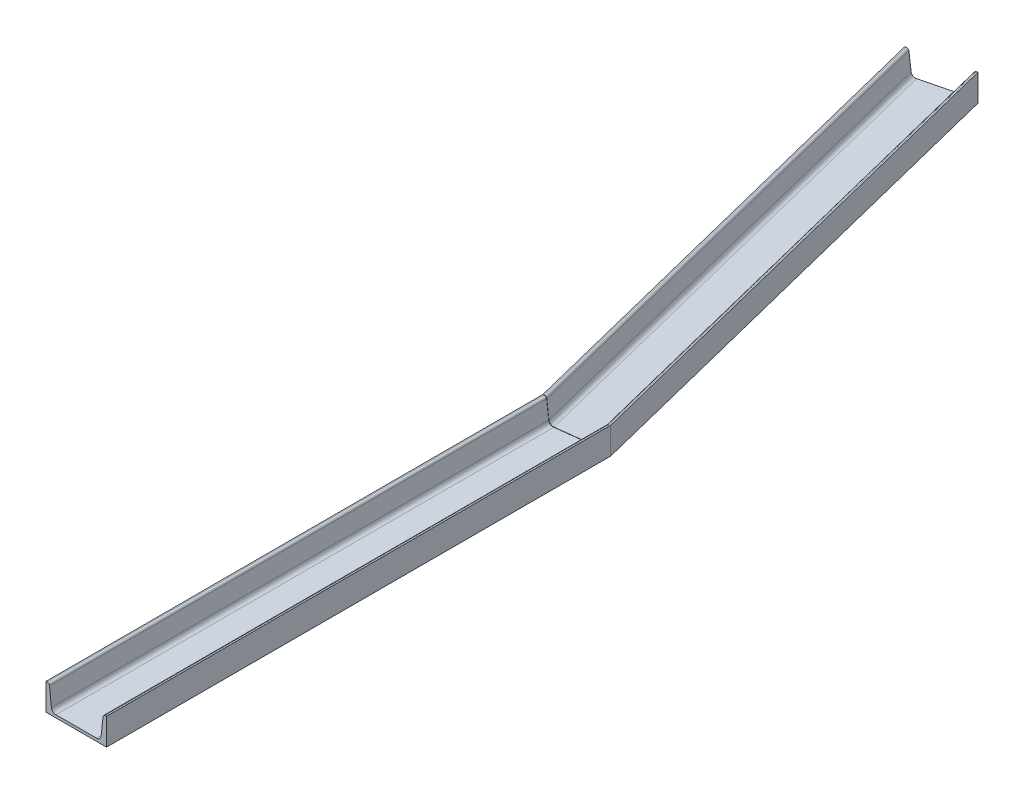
SolidWorks part; units mm, degrees
ref_plane "前视基准面" through (0, 0, 0) normal (0, 0, 1) x (1, 0, 0)
ref_plane "上视基准面" through (0, 0, 0) normal (0, 1, 0) x (1, 0, 0)
ref_plane "右视基准面" through (0, 0, 0) normal (1, 0, 0) x (0, 0, -1)
sketch "草图1" plane through (0, 0, 0) normal (0, 0, 1) x (1, 0, 0)
  line L0 (-60, 0) -> (60, 0)
  line L1 (60, 0) -> (60, 53)
  line L2 (60, 53) -> (57.5512, 53)
  line L3 (53.0759, 48.9711) -> (49.3482, 13.5578)
  line L4 (40.3976, 5.5) -> (-40.3976, 5.5)
  line L5 (-49.3482, 13.5578) -> (-53.0759, 48.9711)
  line L6 (-57.5512, 53) -> (-60, 53)
  line L7 (-60, 53) -> (-60, 0)
  line L8 (-60, 29.25) -> (-51, 29.25) construction
  line L9 (51, 29.25) -> (60, 29.25) construction
  arc A0 (-40.3976, 5.5) -> (-49.3482, 13.5578) centre (-40.3976, 14.5) cw
  arc A1 (49.3482, 13.5578) -> (40.3976, 5.5) centre (40.3976, 14.5) cw
  arc A2 (-53.0759, 48.9711) -> (-57.5512, 53) centre (-57.5512, 48.5) ccw
  arc A3 (57.5512, 53) -> (53.0759, 48.9711) centre (57.5512, 48.5) ccw
  point P19 (-53.5, 53)
  point P22 (53.5, 53)
  dimension "D11" = 9
  dimension "D12" = 4.5
  dimension "D1" = 120
  dimension "D2" = 60
  dimension "D3" = 5.5
  dimension "D4" = 6.5
  dimension "D5" = 6.5
  dimension "D6" = 53
  dimension "D7" = 53
  dimension "D8" = 23.75
  dimension "D9" = 9
  dimension "D10" = 9
extrude "拉伸1" add sketch "草图1" along normal blind 1000
ref_plane "基准面3" through (3.5116, 0, 14.0841) normal (-0.2419, 0, -0.9703) x (-0.9703, 0, 0.2419)
sketch "草图11" plane through (3.5116, 0, 14.0841) normal (-0.2419, 0, -0.9703) x (-0.9703, 0, 0.2419)
  line L0 (-58.2177, 0) -> (-58.2177, 53)
  line L1 (-58.2177, 53) -> (-55.7689, 53)
  line L2 (297.7636, 53) -> (55.8417, 53) construction
  line L3 (-51.2936, 48.9711) -> (-47.5659, 13.5578)
  line L4 (-39.1977, 5.5) -> (39.1977, 5.5) construction
  line L5 (-38.6154, 5.5) -> (42.1799, 5.5)
  line L6 (281.1196, 5.5) -> (39.1977, 5.5) construction
  line L7 (51.1304, 13.5578) -> (54.8582, 48.9711)
  line L8 (59.3334, 53) -> (61.7823, 53)
  line L9 (61.7823, 53) -> (61.7823, 0)
  line L10 (61.7823, 0) -> (-58.2177, 0)
  line L11 (-58.2177, 29.25) -> (-49.2177, 29.25) construction
  line L12 (52.7823, 29.25) -> (61.7823, 29.25) construction
  arc A0 (-55.7689, 53) -> (-51.2936, 48.9711) centre (-55.7689, 48.5) cw
  arc A1 (54.8582, 48.9711) -> (59.3334, 53) centre (59.3334, 48.5) cw
  arc A2 (-47.5659, 13.5578) -> (-38.6154, 5.5) centre (-38.6154, 14.5) ccw
  arc A3 (42.1799, 5.5) -> (51.1304, 13.5578) centre (42.1799, 14.5) ccw
  point P24 (-51.7177, 53)
  point P27 (55.2823, 53)
  point P30 (-46.7177, 5.5)
  point P33 (50.2823, 5.5)
  dimension "D7" = 4.5
  dimension "D8" = 9
  dimension "D1" = 6.5
  dimension "D2" = 6.5
  dimension "D3" = 120
  dimension "D4" = 23.75
  dimension "D5" = 9
  dimension "D6" = 9
extrude "拉伸6" add sketch "草图11" along normal blind 1000
sketch "草图12" plane through (0, 0, 0) normal (0, -1, 0) x (1, 0, 0)
  line L0 (60, 0) -> (-60, 14.7341) construction
  line L1 (-77.8315, 17.1755) -> (55.5063, 0.8036)
  line L2 (55.5063, 0.8036) -> (55.4454, 0.3074)
  line L3 (55.4454, 0.3074) -> (-77.8315, 16.6717)
  line L4 (-77.8315, 16.6717) -> (-77.8315, 17.1755)
  dimension "D1" = 0.5
extrude "切除-拉伸4" cut sketch "草图12" against normal blind 1000
sketch "草图13" plane through (-238.4103, 0, -956.2116) normal (-0.2419, 0, -0.9703) x (-0.9703, 0, 0.2419)
  line L0 (-55.7689, 53) -> (59.3334, 53)
  line L8 (-58.2177, 0) -> (61.7823, 0)
  line L9 (61.7823, 0) -> (61.7823, 53)
  line L10 (61.7823, 53) -> (59.3334, 53)
  line L11 (54.8582, 48.9711) -> (51.1304, 13.5578)
  line L12 (42.1799, 5.5) -> (-38.6154, 5.5)
  line L13 (-47.5659, 13.5578) -> (-51.2936, 48.9711)
  line L14 (-55.7689, 53) -> (-58.2177, 53)
  line L15 (-58.2177, 53) -> (-58.2177, 0)
  line L19 (54.8582, 48.9711) -> (51.1304, 13.5578)
  line L20 (42.1799, 5.5) -> (-38.6154, 5.5)
  line L21 (-47.5659, 13.5578) -> (-51.2936, 48.9711)
  arc A4 (59.3334, 53) -> (54.8582, 48.9711) centre (59.3334, 48.5) ccw
  arc A5 (42.1799, 5.5) -> (51.1304, 13.5578) centre (42.1799, 14.5) ccw
  arc A6 (-47.5659, 13.5578) -> (-38.6154, 5.5) centre (-38.6154, 14.5) ccw
  arc A7 (-51.2936, 48.9711) -> (-55.7689, 53) centre (-55.7689, 48.5) ccw
  arc A8 (59.3334, 53) -> (54.8582, 48.9711) centre (59.3334, 48.5) ccw
  arc A9 (42.1799, 5.5) -> (51.1304, 13.5578) centre (42.1799, 14.5) ccw
  arc A10 (-47.5659, 13.5578) -> (-38.6154, 5.5) centre (-38.6154, 14.5) ccw
  arc A11 (-51.2936, 48.9711) -> (-55.7689, 53) centre (-55.7689, 48.5) ccw
  dimension "D1" = 0
extrude "切除-拉伸5" cut sketch "草图13" against normal up to surface (985.3147 mm away)
sketch "草图14" plane through (0, 0, 1000) normal (0, 0, 1) x (1, 0, 0)
  line L0 (-57.5512, 53) -> (57.5512, 53)
  line L8 (-60, 53) -> (-60, 0)
  line L9 (-60, 0) -> (60, 0)
  line L10 (60, 0) -> (60, 53)
  line L11 (60, 53) -> (57.5512, 53)
  line L12 (53.0759, 48.9711) -> (49.3482, 13.5578)
  line L13 (40.3976, 5.5) -> (-40.3976, 5.5)
  line L14 (-49.3482, 13.5578) -> (-53.0759, 48.9711)
  line L15 (-57.5512, 53) -> (-60, 53)
  line L20 (53.0759, 48.9711) -> (49.3482, 13.5578)
  line L21 (40.3976, 5.5) -> (-40.3976, 5.5)
  line L22 (-49.3482, 13.5578) -> (-53.0759, 48.9711)
  arc A4 (57.5512, 53) -> (53.0759, 48.9711) centre (57.5512, 48.5) ccw
  arc A5 (40.3976, 5.5) -> (49.3482, 13.5578) centre (40.3976, 14.5) ccw
  arc A6 (-49.3482, 13.5578) -> (-40.3976, 5.5) centre (-40.3976, 14.5) ccw
  arc A7 (-53.0759, 48.9711) -> (-57.5512, 53) centre (-57.5512, 48.5) ccw
  arc A8 (57.5512, 53) -> (53.0759, 48.9711) centre (57.5512, 48.5) ccw
  arc A9 (40.3976, 5.5) -> (49.3482, 13.5578) centre (40.3976, 14.5) ccw
  arc A10 (-49.3482, 13.5578) -> (-40.3976, 5.5) centre (-40.3976, 14.5) ccw
  arc A11 (-53.0759, 48.9711) -> (-57.5512, 53) centre (-57.5512, 48.5) ccw
  dimension "D1" = 0
extrude "切除-拉伸6" cut sketch "草图14" against normal up to surface (999.4474 mm away)
